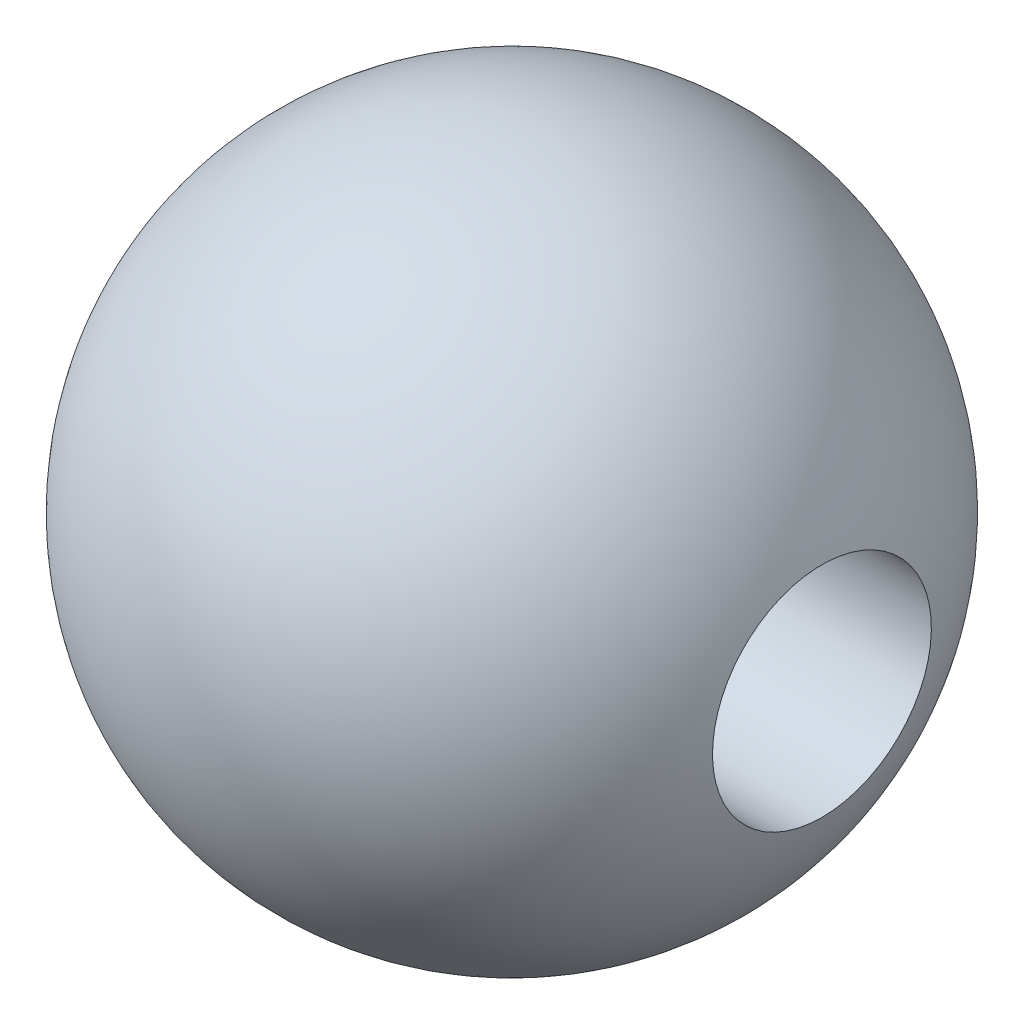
SolidWorks part; units mm, degrees
ref_plane "Front Plane" through (0, 0, 0) normal (0, 0, 1) x (1, 0, 0)
ref_plane "Top Plane" through (0, 0, 0) normal (0, 1, 0) x (1, 0, 0)
ref_plane "Right Plane" through (0, 0, 0) normal (1, 0, 0) x (0, 0, -1)
sketch "Sketch1" plane through (0, 0, 0) normal (0, 0, 1) x (1, 0, 0)
  line L0 (-11, 0) -> (-0.6077, 0) construction
  line L1 (-11, 3) -> (-10, 2)
  line L2 (-5.24, 6) -> (3.1534, 6) construction
  line L3 (-10, 2) -> (-0.1237, 2)
  arc A1 (-0.1237, 2) -> (-11, 3) centre (-5.7894, 0.0252) ccw
  dimension "D2" = 45
  dimension "D1" = 6
  dimension "D6" = 6
  dimension "D3" = 1
  dimension "D4" = 4
  dimension "D5" = 11
revolve "Revolve1" add sketch "Sketch1" angle 360 about L0
